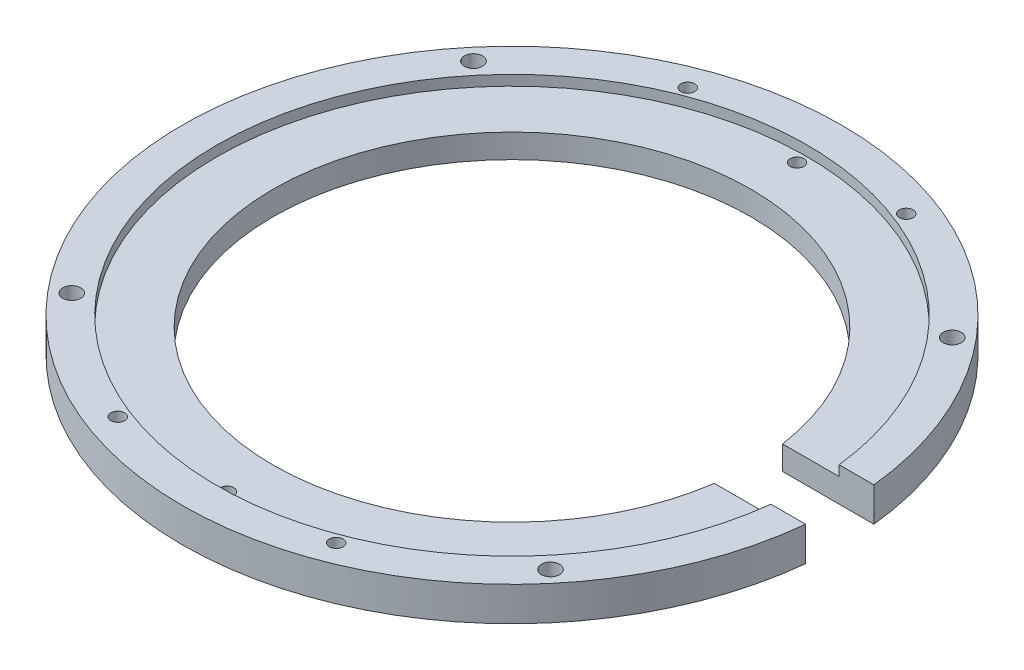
SolidWorks part; units mm, degrees
ref_plane "Front Plane" through (0, 0, 0) normal (0, 0, 1) x (1, 0, 0)
ref_plane "Top Plane" through (0, 0, 0) normal (0, 1, 0) x (1, 0, 0)
ref_plane "Right Plane" through (0, 0, 0) normal (1, 0, 0) x (0, 0, -1)
sketch "Sketch1" plane through (0, 0, 0) normal (0, 0, 1) x (1, 0, 0)
  line L0 (-88.9, 0) -> (-122.6185, 0)
  line L1 (-122.6185, 0) -> (-122.6185, 12.7)
  line L2 (-109.7915, 8.89) -> (-109.7915, 12.7)
  line L3 (-109.7915, 12.7) -> (-122.6185, 12.7)
  line L4 (-109.7915, 8.89) -> (-88.9, 8.89)
  line L5 (0, 0) -> (0, 38.6794) construction
  line L7 (-88.9, 8.89) -> (-88.9, 0)
  line L8 (-109.5375, 11.43) -> (-109.5375, 7.62) construction
  dimension "D1" = 12.7
  dimension "D2" = 245.237
  dimension "D3" = 0.254
  dimension "D4" = 177.8
  dimension "D5" = 3.81
revolve "Revolve1" add sketch "Sketch1" angle 360 about L5
hole_wizard "1/4-20 Tapped Hole1" positions "Sketch4" profile "Sketch5" tap size "1/4-20" standard "ANSI Inch"
sketch "Sketch4" plane through (0, 0, 0) normal (0, -1, 0) x (-1, 0, 0)
  line L0 (-40.64, 106.045) -> (40.64, 106.045) construction
  line L2 (0, 0) -> (-35.2198, 0) construction
  point P0 (40.64, -106.045)
  point P2 (-40.64, -106.045)
  point P4 (40.64, 106.045)
  point P6 (-40.64, 106.045)
  point P29 (0, 106.045)
  point P31 (0, -106.045)
  dimension "D1" = 81.28
  dimension "D2" = 106.045
sketch "Sketch5" plane through (-40.64, 0, 106.045) normal (1, 0, 0) x (0, 0, -1)
  line L0 (0, 0) -> (0, 12.7)
  line L1 (0, 12.7) -> (2.5527, 12.7)
  line L2 (2.5527, 12.7) -> (2.5527, 0)
  line L5 (2.5527, 0) -> (0, 0)
  line L11 (0, -6.35) -> (0, 107.95) construction
  dimension "Thru Tap Drill Dia." = 5.1054
  dimension "Thru Tap Drill Depth" = 12.7
hole_wizard "17/64 (0.26563) Diameter Hole1" positions "Sketch6" profile "Sketch7" hole size "17/64" standard "ANSI Inch"
sketch "Sketch6" plane through (0, 0, 0) normal (0, -1, 0) x (-1, 0, 0)
  line L0 (0, 0) -> (0, -40.2533) construction
  circle A1 centre (-89.0668, 74.736) radius 3.3735 construction
  arc A2 (-85.8015, -78.6275) -> (-92.3322, -70.8444) centre (-89.0668, -74.736) ccw construction
  point P0 (89.0668, 74.736)
  point P15 (89.0668, -74.736)
  point P18 (-89.0668, -74.736)
  point P21 (-89.0668, 74.736)
sketch "Sketch7" plane through (-89.0668, 0, -74.736) normal (1, 0, 0) x (0, 0, -1)
  line L0 (0, 0) -> (0, 12.7)
  line L1 (0, 12.7) -> (3.3735, 12.7)
  line L2 (3.3735, 12.7) -> (3.3735, 0)
  line L5 (3.3735, 0) -> (0, 0)
  line L11 (0, -6.35) -> (0, 107.95) construction
  dimension "Thru Hole Dia." = 6.747
  dimension "Thru Hole Depth" = 12.7
sketch "Sketch8" plane through (0, 0, 0) normal (0, -1, 0) x (1, 0, 0)
  line L1 (61.1298, 12.7) -> (137.3298, 12.7)
  line L2 (61.1298, 12.7) -> (61.1298, -12.7)
  line L3 (61.1298, -12.7) -> (137.3298, -12.7)
  line L4 (137.3298, 12.7) -> (137.3298, -12.7)
  line L5 (61.1298, 12.7) -> (137.3298, -12.7) construction
  line L6 (61.1298, -12.7) -> (137.3298, 12.7) construction
  point P0 (99.2298, 0)
  dimension "D1" = 25.4
  dimension "D2" = 76.2
extrude "Cut-Extrude1" cut sketch "Sketch8" against normal through all
